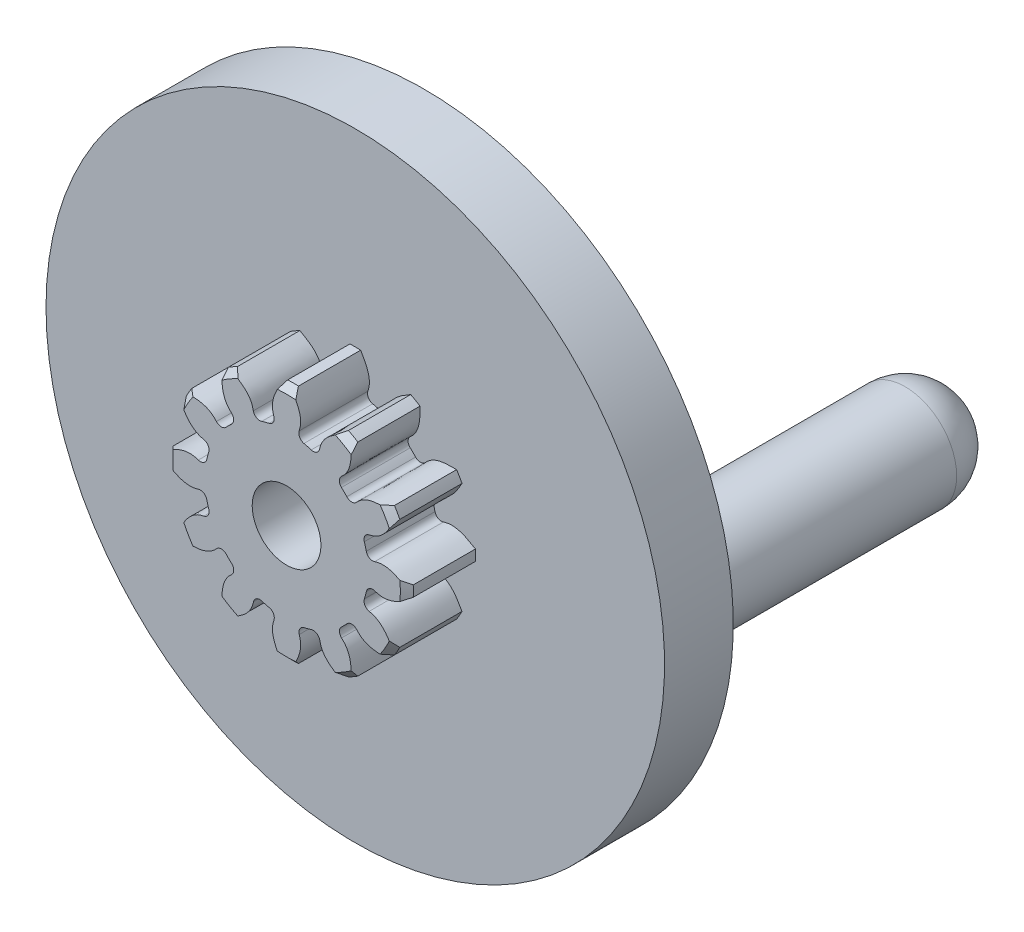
SolidWorks part; units mm, degrees
ref_plane "Plan1" through (0, 0, 0) normal (0, 0, 1) x (1, 0, 0)
ref_plane "Plan2" through (0, 0, 0) normal (0, 1, 0) x (1, 0, 0)
ref_plane "Plan3" through (0, 0, 0) normal (1, 0, 0) x (0, 0, -1)
sketch "Dent" plane through (0, 0, 0) normal (0, 0, 1) x (1, 0, 0)
  line L1 (-0.1565, 2.0815) -> (0, 1.6516)
  line L3 (0, 3.5) -> (0, -3.5) construction
  line L4 (0, 0) -> (0.1565, 3.4965) construction
  line L5 (0.3927, 2.9742) -> (-0.3927, 2.9742) construction
  line L6 (0.4106, 2.789) -> (-0.4106, 2.789) construction
  line L7 (-0.25, 0) -> (0.25, 0) construction
  line L9 (0.1565, 2.0815) -> (0, 1.6516)
  line L11 (0, 0) -> (0.3927, 2.9742) construction
  line L12 (0, 0) -> (0.4106, 2.789) construction
  circle A0 centre (0, 0) radius 3 construction
  circle A1 centre (0, 0) radius 3.5 construction
  arc A2 (0.1565, 3.4965) -> (-0.1565, 3.4965) centre (0, 0) ccw
  circle A3 centre (0, 0) radius 2.8191 construction
  point P2 (-0.3927, 2.9742)
  point P3 (-0.4106, 2.789)
  point P19 (0.3927, 2.9742)
  point P20 (0.4106, 2.789)
sketch "Esquisse2" plane through (0, 0, 0) normal (0, 0, 1) x (1, 0, 0)
  circle A0 centre (0, 0) radius 2.375
extrude "Base-Extrusion" add sketch "Esquisse2" against normal blind 2
extrude "Boss.-Extru.1" add sketch "Dent" against normal blind 2
fillet "Congé1" radius 0.19 4 edges at (0.2793, 2.3585, -1) (-0.2875, 2.3575, -1)
chamfer "Chanfrein1" distance 0.19 angle 45 2 edges at (0, 3.5, 0)
pattern_circular "Répétition circulaire1" count 12 over 360 of "Congé1", "Boss.-Extru.1", "Chanfrein1"
sketch "Esquisse3" plane through (0, 0, -2) normal (0, 0, -1) x (-1, 0, 0)
  circle A0 centre (0, 0) radius 9
  dimension "D1" = 18
extrude "Extrusion1" add sketch "Esquisse3" along normal blind 2
sketch "Esquisse4" plane through (0, 0, -4) normal (0, 0, -1) x (-1, 0, 0)
  circle A0 centre (0, 0) radius 2
  dimension "D1" = 4
extrude "Enlèv. mat.-Extru.1" cut sketch "Esquisse4" against normal blind 1
sketch "Esquisse5" plane through (0, 0, -3) normal (0, 0, -1) x (-1, 0, 0)
  circle A0 centre (0, 0) radius 1
  dimension "D1" = 2
extrude "Enlèv. mat.-Extru.2" cut sketch "Esquisse5" against normal through all
sketch "Esquisse6" plane through (0, 0, -4) normal (0, 0, -1) x (-1, 0, 0)
  circle A0 centre (-7, 0) radius 1.5
  dimension "D2" = 3
  dimension "D1" = 7
extrude "Extrusion2" add sketch "Esquisse6" along normal blind 8.5
fillet "Congé2" radius 1.5 1 edges at (5.5, 0, -12.5)
equation "\"Dp@Dent\" = \"Module@Dent\"*\"Nbr de dents@Répétition circulaire1\" "
equation "\"Dt@Dent\" = \"Module@Dent\"*(\"Nbr de dents@Répétition circulaire1\"+2)"
equation "\"Dpied@Esquisse2\" = \"Dp@Dent\"-(2.5*\"Module@Dent\")"
equation "\"Db@Dent\" = \"Dp@Dent\"*cos(\"Angle de pression@Dent\"*pi/180)"
equation "\"Ep au primitif@Dent\" =  (pi*\"Dp@Dent\"/2)/\"Nbr de dents@Répétition circulaire1\""
equation "\"D3@Dent\"=atn((Sin((sqr(((\"Dt@Dent\"/\"Db@Dent\")^2)-1))) -((sqr(((\"Dt@Dent\"/\"Db@Dent\")^2)-1)) * Cos((sqr(((\"Dt@Dent\"/\"Db@Dent\")^2)-1)))))/(Cos((sqr(((\"Dt@Dent\"/\"Db@Dent\")^2)-1))) +((sqr(((\"Dt@Dent\"/\"Db@"
equation "\"D4@Dent\"=atn((Sin((sqr(((\"Dp@Dent\"/\"Db@Dent\")^2)-1))) -((sqr(((\"Dp@Dent\"/\"Db@Dent\")^2)-1)) * Cos((sqr(((\"Dp@Dent\"/\"Db@Dent\")^2)-1)))))/(Cos((sqr(((\"Dp@Dent\"/\"Db@Dent\")^2)-1))) +((sqr(((\"Dp@Dent\"/\"Db@"
equation "\"D1@Congé1\" = \"Module@Dent\"*0.38"
equation "\"D1@Chanfrein1\" = \"Module@Dent\"*0.38"
equation "\"D1@Base-Extrusion\" = \"Epaisseur@Boss.-Extru.1\""
